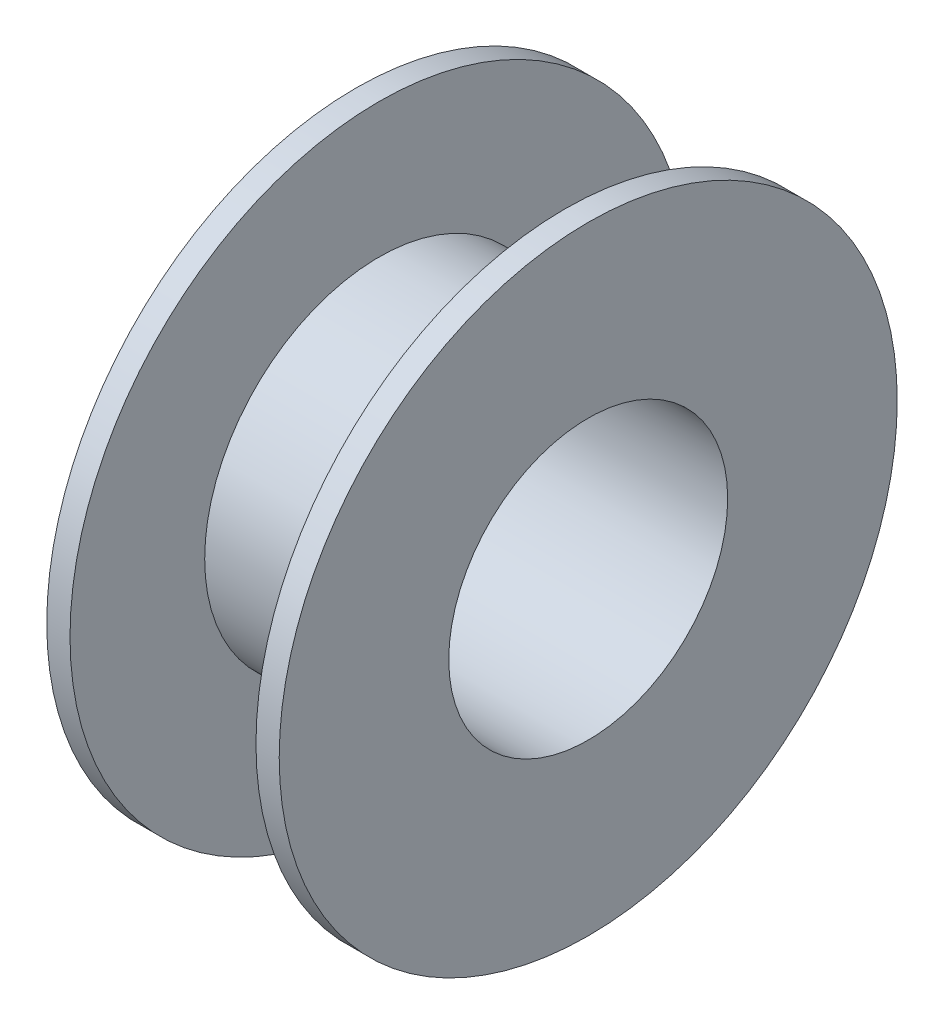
SolidWorks part; units mm, degrees
ref_plane "Alzado" through (0, 0, 0) normal (0, 0, 1) x (1, 0, 0)
ref_plane "Planta" through (0, 0, 0) normal (0, 1, 0) x (1, 0, 0)
ref_plane "Vista lateral" through (0, 0, 0) normal (1, 0, 0) x (0, 0, -1)
sketch "Croquis1" plane through (0, 0, 0) normal (0, 0, 1) x (1, 0, 0)
  line L0 (0, 0) -> (9.9084, 0) construction
  line L2 (1, 7.5) -> (9, 7.5)
  line L4 (0, 6) -> (10, 6)
  line L7 (0, 6) -> (0, 13.2941)
  line L8 (0, 13.2941) -> (1, 13.2941)
  line L9 (1, 7.5) -> (1, 13.2941)
  line L11 (10, 6) -> (10, 13.2941)
  line L12 (10, 13.2941) -> (9, 13.2941)
  line L13 (9, 7.5) -> (9, 13.2941)
  dimension "D1" = 12
  dimension "D2" = 15
  dimension "D3" = 10
  dimension "D4" = 1
revolve "Revolución1" add sketch "Croquis1" angle 360 about L0
